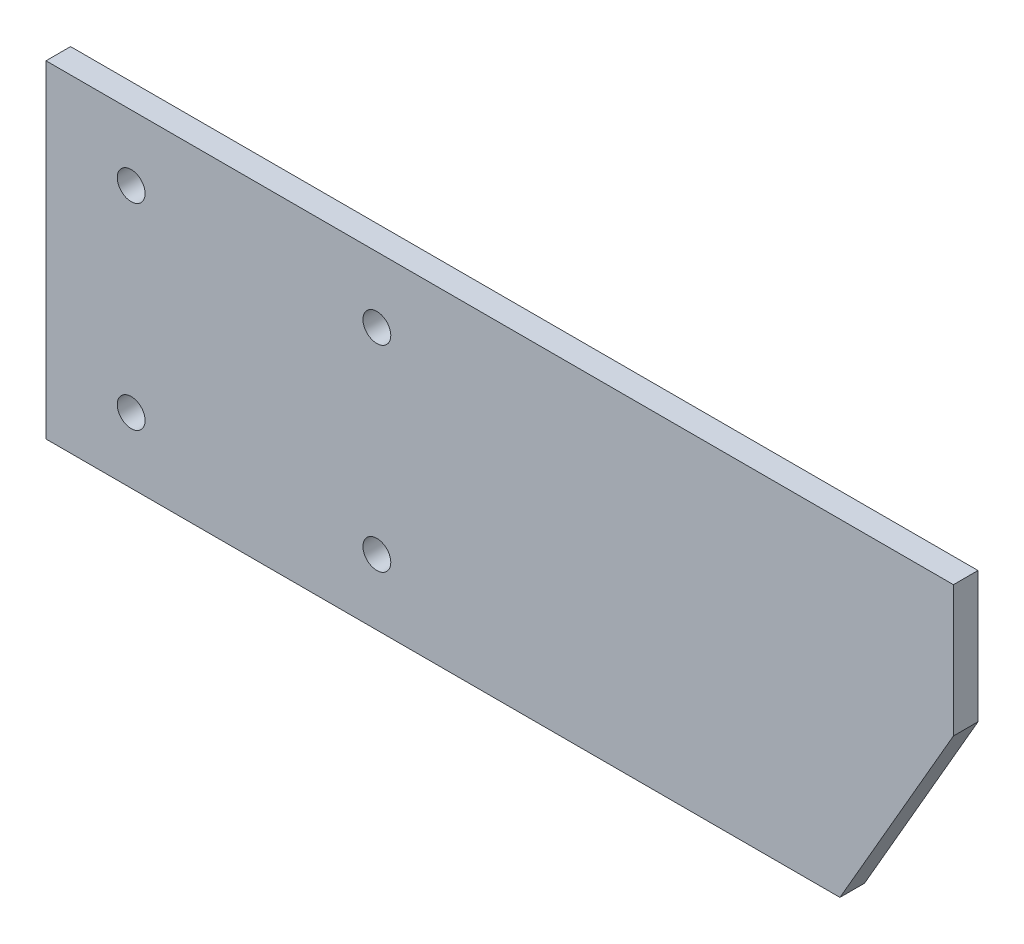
SolidWorks part; units mm, degrees
ref_plane "Front Plane" through (0, 0, 0) normal (0, 0, 1) x (1, 0, 0)
ref_plane "Top Plane" through (0, 0, 0) normal (0, 1, 0) x (1, 0, 0)
ref_plane "Right Plane" through (0, 0, 0) normal (1, 0, 0) x (0, 0, -1)
sketch "Sketch1" plane through (0, 0, 0) normal (0, 0, 1) x (1, 0, 0)
  line L0 (-127, 100) -> (427, 100)
  line L1 (-127, 100) -> (-127, -100)
  line L2 (-127, -100) -> (357.718, -100)
  line L3 (357.718, -100) -> (427, 20)
  line L4 (427, 20) -> (427, 100)
  circle A0 centre (-75, 60) radius 8.5
  circle A1 centre (75, 60) radius 8.5
  circle A2 centre (75, -60) radius 8.5
  circle A3 centre (-75, -60) radius 8.5
  dimension "D7" = 17
  dimension "D1" = 554
  dimension "D2" = 200
  dimension "D3" = 127
  dimension "D4" = 100
  dimension "D5" = 60
  dimension "D6" = 80
  dimension "D8" = 60
  dimension "D9" = 60
  dimension "D10" = 75
  dimension "D11" = 75
extrude "Extrude1" add sketch "Sketch1" along normal blind 15
ref_plane "Plane1" through (0, 0, 10) normal (0, 0, 1) x (1, 0, 0)
sketch "Sketch2" plane through (0, 0, 10) normal (0, 0, 1) x (1, 0, 0)
  line L0 (-127, -100) -> (357.718, -100) construction
  line L1 (-127, 100) -> (127, 100)
  line L2 (-127, 100) -> (-127, -100)
  line L3 (-127, -100) -> (127, -100)
  line L4 (127, 100) -> (127, -100)
  dimension "D1" = 254
